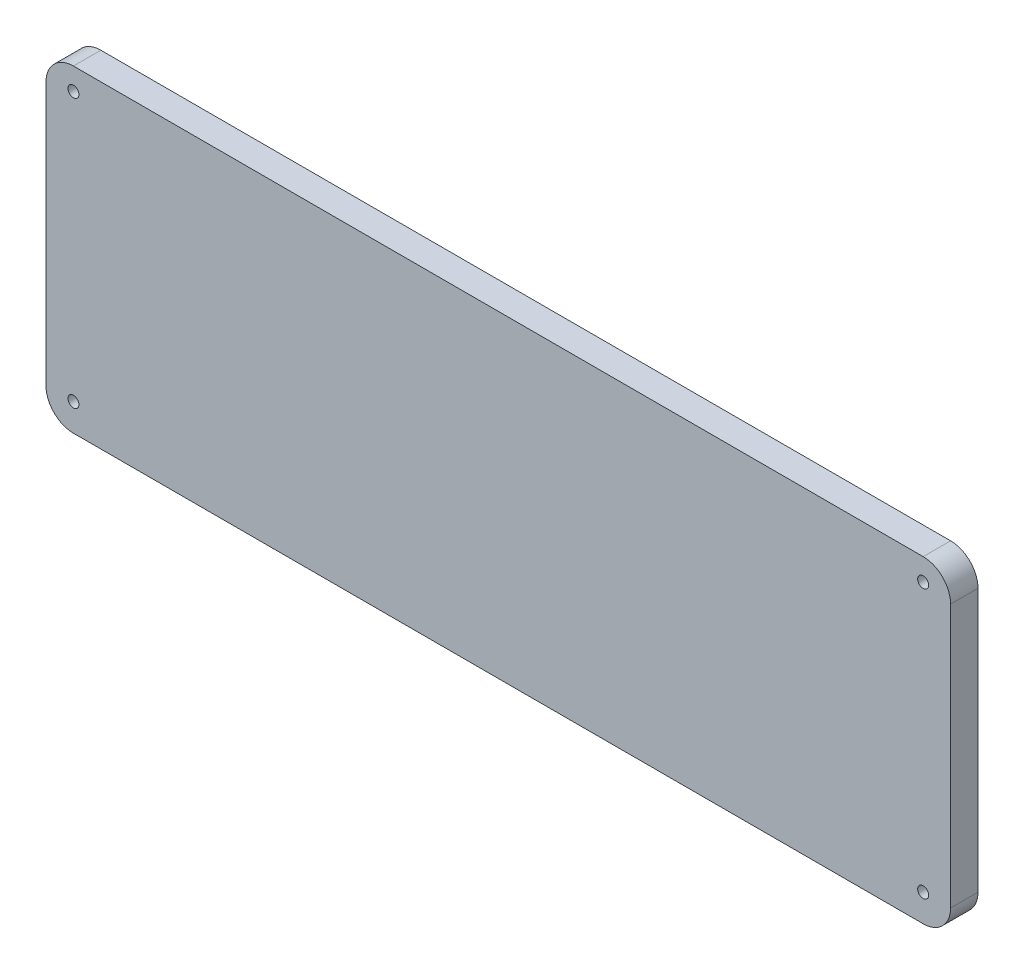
SolidWorks part; units mm, degrees
other "<网格板>-<切除-拉伸4>"
ref_plane "前视基准面" through (0, 0, 0) normal (0, 0, 1) x (1, 0, 0)
ref_plane "上视基准面" through (0, 0, 0) normal (0, 1, 0) x (1, 0, 0)
ref_plane "右视基准面" through (0, 0, 0) normal (1, 0, 0) x (0, 0, -1)
inserted part "网格板"
sketch "草图4" plane through (0, 0, 10) normal (0, 0, 1) x (1, 0, 0)
  line L1 (-147.7194, 47.3122) -> (148.3969, 47.3122)
  line L2 (-147.7194, 47.3122) -> (-147.7194, -46.0058)
  line L3 (-147.7194, -46.0058) -> (148.3969, -46.0058)
  line L4 (148.3969, 47.3122) -> (148.3969, -46.0058)
extrude "凸台-拉伸2" add sketch "草图4" against normal up to surface (10 mm away)
